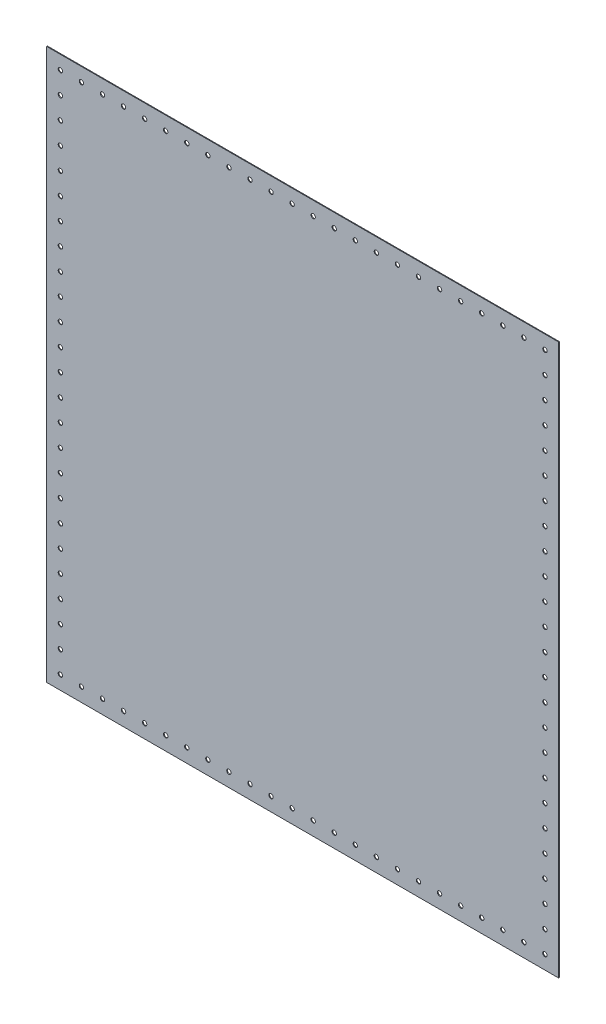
SolidWorks part; units mm, degrees
ref_plane "Front Plane" through (0, 0, 0) normal (1, 0, 0) x (0, 1, 0)
ref_plane "Top Plane" through (0, 0, 0) normal (0, 0, 1) x (0, 1, 0)
ref_plane "Right Plane" through (0, 0, 0) normal (0, 1, 0) x (-1, 0, 0)
sketch "sk 48in boundary" plane through (0, 0, 0) normal (0, 0, 1) x (0, 1, 0)
  line L12 (609.6, 609.6) -> (-609.6, 609.6)
  line L13 (609.6, -609.6) -> (609.6, 609.6)
  line L14 (-609.6, -609.6) -> (609.6, -609.6)
  line L15 (-609.6, 609.6) -> (-609.6, -609.6)
  point P0 (0, 609.6)
  point P1 (-609.6, 0)
  dimension "D1" = 1219.2
  dimension "D2" = 1219.2
ref_plane "48\" pnl right edge" through (0, 609.6, 0) normal (0, 1, 0) x (-1, 0, 0)
ref_plane "48\" pnl left edge" through (0, -609.6, 0) normal (0, 1, 0) x (-1, 0, 0)
ref_plane "48\" pnl bot edge" through (609.6, 0, 0) normal (1, 0, 0) x (0, 1, 0)
ref_plane "48\" pnl top edge" through (-609.6, 0, 0) normal (1, 0, 0) x (0, 1, 0)
sketch "sk 47.986in pnl" plane through (0, 0, 0) normal (0, 0, 1) x (0, 1, 0)
  line B0 (-609.4222, 0) -> (609.4222, 0) construction
  line B1 (-609.4222, 566.4) -> (609.4222, 566.4)
  line B2 (-609.4222, 566.4) -> (-609.4222, -566.4)
  line B3 (-609.4222, -566.4) -> (609.4222, -566.4)
  line B4 (609.4222, 566.4) -> (609.4222, -566.4)
  line B5 (0, 566.4) -> (0, -566.4) construction
sketch_block_instance "47.986in pnl-1"
sketch_block "47.986in pnl" parameters "D1"=1132.8, "D2"=1218.8444
sketch "sk 5dia hole pat" plane through (0, 0, 0) normal (0, 0, 1) x (0, 1, 0)
  line L0 (-609.4222, 566.4) -> (-609.4222, -566.4) construction
  line L1 (-609.4222, -566.4) -> (609.4222, -566.4) construction
  line L2 (-609.4222, 566.4) -> (609.4222, 566.4) construction
  line L3 (609.4222, 566.4) -> (609.4222, -566.4) construction
  circle B0 centre (-579.12, -536.0978) radius 4.826
  circle B1 centre (579.12, 622.1422) radius 4.826
  circle B2 centre (-530.86, -536.0978) radius 4.826
  circle B3 centre (-482.6, -536.0978) radius 4.826
  circle B4 centre (-434.34, -536.0978) radius 4.826
  circle B5 centre (-386.08, -536.0978) radius 4.826
  circle B6 centre (-337.82, -536.0978) radius 4.826
  circle B7 centre (-289.56, -536.0978) radius 4.826
  circle B8 centre (-241.3, -536.0978) radius 4.826
  circle B9 centre (-193.04, -536.0978) radius 4.826
  circle B10 centre (-144.78, -536.0978) radius 4.826
  circle B11 centre (-96.52, -536.0978) radius 4.826
  circle B12 centre (-48.26, -536.0978) radius 4.826
  circle B13 centre (0, -536.0978) radius 4.826
  circle B14 centre (48.26, -536.0978) radius 4.826
  circle B15 centre (96.52, -536.0978) radius 4.826
  circle B16 centre (144.78, -536.0978) radius 4.826
  circle B17 centre (193.04, -536.0978) radius 4.826
  circle B18 centre (241.3, -536.0978) radius 4.826
  circle B19 centre (289.56, -536.0978) radius 4.826
  circle B20 centre (337.82, -536.0978) radius 4.826
  circle B21 centre (386.08, -536.0978) radius 4.826
  circle B22 centre (434.34, -536.0978) radius 4.826
  circle B23 centre (482.6, -536.0978) radius 4.826
  circle B24 centre (530.86, -536.0978) radius 4.826
  circle B25 centre (579.12, -536.0978) radius 4.826
  circle B26 centre (-579.12, -487.8378) radius 4.826
  circle B27 centre (-579.12, -439.5778) radius 4.826
  circle B28 centre (-579.12, -391.3178) radius 4.826
  circle B29 centre (-579.12, -343.0578) radius 4.826
  circle B30 centre (-579.12, -294.7978) radius 4.826
  circle B31 centre (-579.12, -246.5378) radius 4.826
  circle B32 centre (-579.12, -198.2778) radius 4.826
  circle B33 centre (-579.12, -150.0178) radius 4.826
  circle B34 centre (-579.12, -101.7578) radius 4.826
  circle B35 centre (-579.12, -53.4978) radius 4.826
  circle B36 centre (-579.12, -5.2378) radius 4.826
  circle B37 centre (-579.12, 43.0222) radius 4.826
  circle B38 centre (-579.12, 91.2822) radius 4.826
  circle B39 centre (-579.12, 139.5422) radius 4.826
  circle B40 centre (-579.12, 187.8022) radius 4.826
  circle B41 centre (-579.12, 236.0622) radius 4.826
  circle B42 centre (-579.12, 284.3222) radius 4.826
  circle B43 centre (-579.12, 332.5822) radius 4.826
  circle B44 centre (-579.12, 380.8422) radius 4.826
  circle B45 centre (-579.12, 429.1022) radius 4.826
  circle B46 centre (-579.12, 477.3622) radius 4.826
  circle B47 centre (-579.12, 525.6222) radius 4.826
  circle B48 centre (-579.12, 573.8822) radius 4.826
  circle B49 centre (-579.12, 622.1422) radius 4.826
  circle B50 centre (530.86, 622.1422) radius 4.826
  circle B51 centre (482.6, 622.1422) radius 4.826
  circle B52 centre (434.34, 622.1422) radius 4.826
  circle B53 centre (386.08, 622.1422) radius 4.826
  circle B54 centre (337.82, 622.1422) radius 4.826
  circle B55 centre (289.56, 622.1422) radius 4.826
  circle B56 centre (241.3, 622.1422) radius 4.826
  circle B57 centre (193.04, 622.1422) radius 4.826
  circle B58 centre (144.78, 622.1422) radius 4.826
  circle B59 centre (96.52, 622.1422) radius 4.826
  circle B60 centre (48.26, 622.1422) radius 4.826
  circle B61 centre (0, 622.1422) radius 4.826
  circle B62 centre (-48.26, 622.1422) radius 4.826
  circle B63 centre (-96.52, 622.1422) radius 4.826
  circle B64 centre (-144.78, 622.1422) radius 4.826
  circle B65 centre (-193.04, 622.1422) radius 4.826
  circle B66 centre (-241.3, 622.1422) radius 4.826
  circle B67 centre (-289.56, 622.1422) radius 4.826
  circle B68 centre (-337.82, 622.1422) radius 4.826
  circle B69 centre (-386.08, 622.1422) radius 4.826
  circle B70 centre (-434.34, 622.1422) radius 4.826
  circle B71 centre (-482.6, 622.1422) radius 4.826
  circle B72 centre (-530.86, 622.1422) radius 4.826
  circle B73 centre (579.12, 573.8822) radius 4.826
  circle B74 centre (579.12, 525.6222) radius 4.826
  circle B75 centre (579.12, 477.3622) radius 4.826
  circle B76 centre (579.12, 429.1022) radius 4.826
  circle B77 centre (579.12, 380.8422) radius 4.826
  circle B78 centre (579.12, 332.5822) radius 4.826
  circle B79 centre (579.12, 284.3222) radius 4.826
  circle B80 centre (579.12, 236.0622) radius 4.826
  circle B81 centre (579.12, 187.8022) radius 4.826
  circle B82 centre (579.12, 139.5422) radius 4.826
  circle B83 centre (579.12, 91.2822) radius 4.826
  circle B84 centre (579.12, 43.0222) radius 4.826
  circle B85 centre (579.12, -5.2378) radius 4.826
  circle B86 centre (579.12, -53.4978) radius 4.826
  circle B87 centre (579.12, -101.7578) radius 4.826
  circle B88 centre (579.12, -150.0178) radius 4.826
  circle B89 centre (579.12, -198.2778) radius 4.826
  circle B90 centre (579.12, -246.5378) radius 4.826
  circle B91 centre (579.12, -294.7978) radius 4.826
  circle B92 centre (579.12, -343.0578) radius 4.826
  circle B93 centre (579.12, -391.3178) radius 4.826
  circle B94 centre (579.12, -439.5778) radius 4.826
  circle B95 centre (579.12, -487.8378) radius 4.826
  line B96 (0, -536.0978) -> (0, -461.0978) construction
  line B97 (-579.12, 43.0222) -> (-504.12, 43.0222) construction
sketch_block_instance "5dia hole pat-1"
sketch_block "5dia hole pat" parameters "D1"=9.652, "D2"=9.652, "D3"=75, "D4"=5.8411, "D5"=9.7282, "D10"=70.1006, "D6"=30.3022, "D8"=30.3022, "D9"=1218.8444, "D11"=69.8258, "D12"=78.5622, "D14"=48.26, "D16"=48.26
extrude "Panel" add sketch "sk 47.986in pnl" along normal blind 1.5875
sketch "Sketch1" plane through (0, 0, 0) normal (0, 0, 1) x (0, 1, 0)
  line L0 (-609.4222, 566.4) -> (-609.4222, -566.4) construction
  line L1 (-609.4222, -566.4) -> (609.4222, -566.4) construction
  line L2 (609.4222, 566.4) -> (-609.4222, 566.4) construction
  line L3 (609.4222, -566.4) -> (609.4222, 566.4) construction
  circle A0 centre (-579.12, -536.0978) radius 4.826
  circle A1 centre (579.12, 536.0978) radius 4.826
  circle A2 centre (-530.86, -536.0978) radius 4.826
  circle A3 centre (-482.6, -536.0978) radius 4.826
  circle A4 centre (-434.34, -536.0978) radius 4.826
  circle A5 centre (-386.08, -536.0978) radius 4.826
  circle A6 centre (-337.82, -536.0978) radius 4.826
  circle A7 centre (-289.56, -536.0978) radius 4.826
  circle A8 centre (-241.3, -536.0978) radius 4.826
  circle A9 centre (-193.04, -536.0978) radius 4.826
  circle A10 centre (-144.78, -536.0978) radius 4.826
  circle A11 centre (-96.52, -536.0978) radius 4.826
  circle A12 centre (-48.26, -536.0978) radius 4.826
  circle A13 centre (0, -536.0978) radius 4.826
  circle A14 centre (48.26, -536.0978) radius 4.826
  circle A15 centre (96.52, -536.0978) radius 4.826
  circle A16 centre (144.78, -536.0978) radius 4.826
  circle A17 centre (193.04, -536.0978) radius 4.826
  circle A18 centre (241.3, -536.0978) radius 4.826
  circle A19 centre (289.56, -536.0978) radius 4.826
  circle A20 centre (337.82, -536.0978) radius 4.826
  circle A21 centre (386.08, -536.0978) radius 4.826
  circle A22 centre (434.34, -536.0978) radius 4.826
  circle A23 centre (482.6, -536.0978) radius 4.826
  circle A24 centre (530.86, -536.0978) radius 4.826
  circle A25 centre (579.12, -536.0978) radius 4.826
  circle A26 centre (530.86, 536.0978) radius 4.826
  circle A27 centre (482.6, 536.0978) radius 4.826
  circle A28 centre (434.34, 536.0978) radius 4.826
  circle A29 centre (386.08, 536.0978) radius 4.826
  circle A30 centre (337.82, 536.0978) radius 4.826
  circle A31 centre (289.56, 536.0978) radius 4.826
  circle A32 centre (241.3, 536.0978) radius 4.826
  circle A33 centre (193.04, 536.0978) radius 4.826
  circle A34 centre (144.78, 536.0978) radius 4.826
  circle A35 centre (96.52, 536.0978) radius 4.826
  circle A36 centre (48.26, 536.0978) radius 4.826
  circle A37 centre (0, 536.0978) radius 4.826
  circle A38 centre (-48.26, 536.0978) radius 4.826
  circle A39 centre (-96.52, 536.0978) radius 4.826
  circle A40 centre (-144.78, 536.0978) radius 4.826
  circle A41 centre (-193.04, 536.0978) radius 4.826
  circle A42 centre (-241.3, 536.0978) radius 4.826
  circle A43 centre (-289.56, 536.0978) radius 4.826
  circle A44 centre (-337.82, 536.0978) radius 4.826
  circle A45 centre (-386.08, 536.0978) radius 4.826
  circle A46 centre (-434.34, 536.0978) radius 4.826
  circle A47 centre (-482.6, 536.0978) radius 4.826
  circle A48 centre (-530.86, 536.0978) radius 4.826
  circle A49 centre (-579.12, 536.0978) radius 4.826
  circle A50 centre (-579.12, -489.4806) radius 4.826
  circle A51 centre (-579.12, -442.8634) radius 4.826
  circle A52 centre (-579.12, -396.2462) radius 4.826
  circle A53 centre (-579.12, -349.629) radius 4.826
  circle A54 centre (-579.12, -303.0118) radius 4.826
  circle A55 centre (-579.12, -256.3946) radius 4.826
  circle A56 centre (-579.12, -209.7774) radius 4.826
  circle A57 centre (-579.12, -163.1602) radius 4.826
  circle A58 centre (-579.12, -116.543) radius 4.826
  circle A59 centre (-579.12, -69.9258) radius 4.826
  circle A60 centre (-579.12, -23.3086) radius 4.826
  circle A61 centre (-579.12, 23.3086) radius 4.826
  circle A62 centre (-579.12, 69.9258) radius 4.826
  circle A63 centre (-579.12, 116.543) radius 4.826
  circle A64 centre (-579.12, 163.1602) radius 4.826
  circle A65 centre (-579.12, 209.7774) radius 4.826
  circle A66 centre (-579.12, 256.3946) radius 4.826
  circle A67 centre (-579.12, 303.0118) radius 4.826
  circle A68 centre (-579.12, 349.629) radius 4.826
  circle A69 centre (-579.12, 396.2462) radius 4.826
  circle A70 centre (-579.12, 442.8634) radius 4.826
  circle A71 centre (-579.12, 489.4806) radius 4.826
  circle A72 centre (579.12, 489.4806) radius 4.826
  circle A73 centre (579.12, 442.8634) radius 4.826
  circle A74 centre (579.12, 396.2462) radius 4.826
  circle A75 centre (579.12, 349.629) radius 4.826
  circle A76 centre (579.12, 303.0118) radius 4.826
  circle A77 centre (579.12, 256.3946) radius 4.826
  circle A78 centre (579.12, 209.7774) radius 4.826
  circle A79 centre (579.12, 163.1602) radius 4.826
  circle A80 centre (579.12, 116.543) radius 4.826
  circle A81 centre (579.12, 69.9258) radius 4.826
  circle A82 centre (579.12, 23.3086) radius 4.826
  circle A83 centre (579.12, -23.3086) radius 4.826
  circle A84 centre (579.12, -69.9258) radius 4.826
  circle A85 centre (579.12, -116.543) radius 4.826
  circle A86 centre (579.12, -163.1602) radius 4.826
  circle A87 centre (579.12, -209.7774) radius 4.826
  circle A88 centre (579.12, -256.3946) radius 4.826
  circle A89 centre (579.12, -303.0118) radius 4.826
  circle A90 centre (579.12, -349.629) radius 4.826
  circle A91 centre (579.12, -396.2462) radius 4.826
  circle A92 centre (579.12, -442.8634) radius 4.826
  circle A93 centre (579.12, -489.4806) radius 4.826
  dimension "D3" = 9.652
  dimension "D6" = 9.652
  dimension "D1" = 30.3022
  dimension "D2" = 30.3022
  dimension "D4" = 30.3022
  dimension "D5" = 30.3022
  dimension "D7" = 25
  dimension "D8" = 25
  dimension "D9" = 23
  dimension "D10" = 23
extrude "Holes" cut sketch "Sketch1" along normal blind 10
